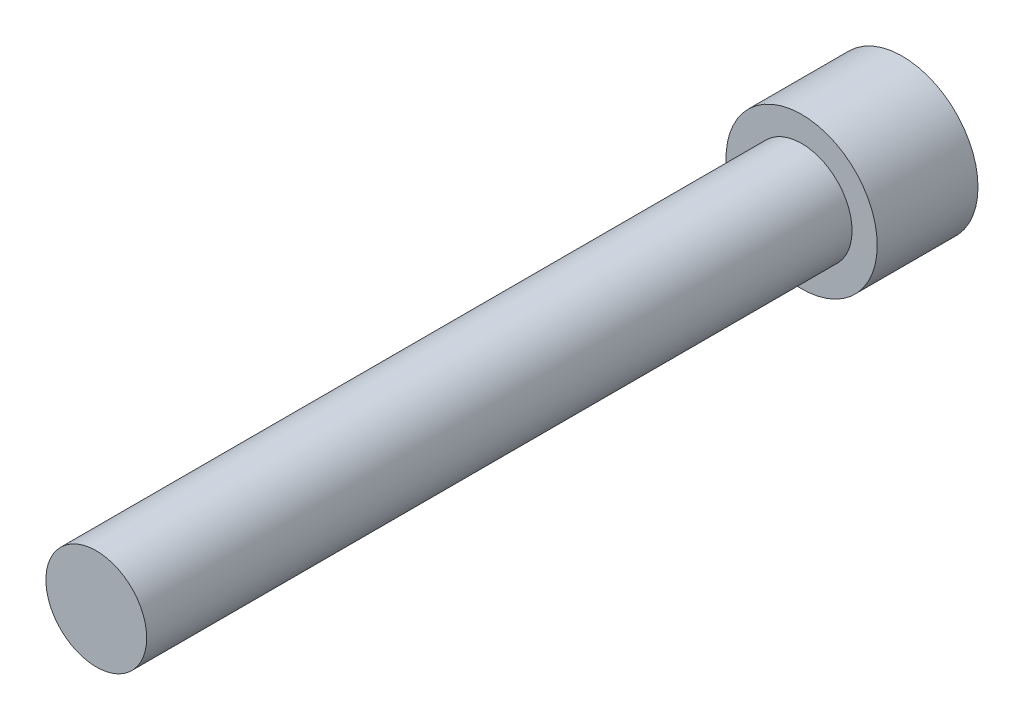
SolidWorks part; units mm, degrees
ref_plane "Front Plane" through (0, 0, 0) normal (0, 0, 1) x (1, 0, 0)
ref_plane "Top Plane" through (0, 0, 0) normal (0, 1, 0) x (1, 0, 0)
ref_plane "Right Plane" through (0, 0, 0) normal (1, 0, 0) x (0, 0, -1)
sketch "Sketch6" plane through (0, 0, 0) normal (1, 0, 0) x (0, 0, -1)
  line L0 (-44.45, 0) -> (22.525, 0) construction
  line L1 (5.2388, 0) -> (-5.2388, 0) construction
  line L2 (-44.45, 0) -> (-44.45, -3.175)
  line L3 (-44.45, -3.175) -> (0, -3.175)
  line L4 (0, 5.2388) -> (0, -5.2388) construction
  line L5 (0, -3.175) -> (0, -4.7625)
  line L6 (0, -4.7625) -> (6.35, -4.7625)
  line L7 (6.35, -4.7625) -> (6.35, 0)
  line L8 (6.35, 0) -> (-44.45, 0)
  dimension "L" = 44.45
  dimension "H" = 6.35
  dimension "A" = 9.525
  dimension "D" = 6.35
revolve "Revolve1" add sketch "Sketch6" angle 360 about L0
sketch "Sketch7" plane through (0, 0, -6.35) normal (0, 0, -1) x (-1, 0, 0)
  line L2 (-2.3876, 1.3785) -> (-2.3876, -1.3785)
  line L4 (-2.3876, -1.3785) -> (0, -2.757)
  line L5 (0, -2.757) -> (2.3876, -1.3785)
  line L6 (2.3876, -1.3785) -> (2.3876, 1.3785)
  line L7 (2.3876, 1.3785) -> (0, 2.757)
  line L8 (0, 2.757) -> (-2.3876, 1.3785)
  circle A0 centre (0, 0) radius 2.3876 construction
  dimension "J" = 4.7752
extrude "HEX" cut sketch "Sketch7" against normal blind 3.556
